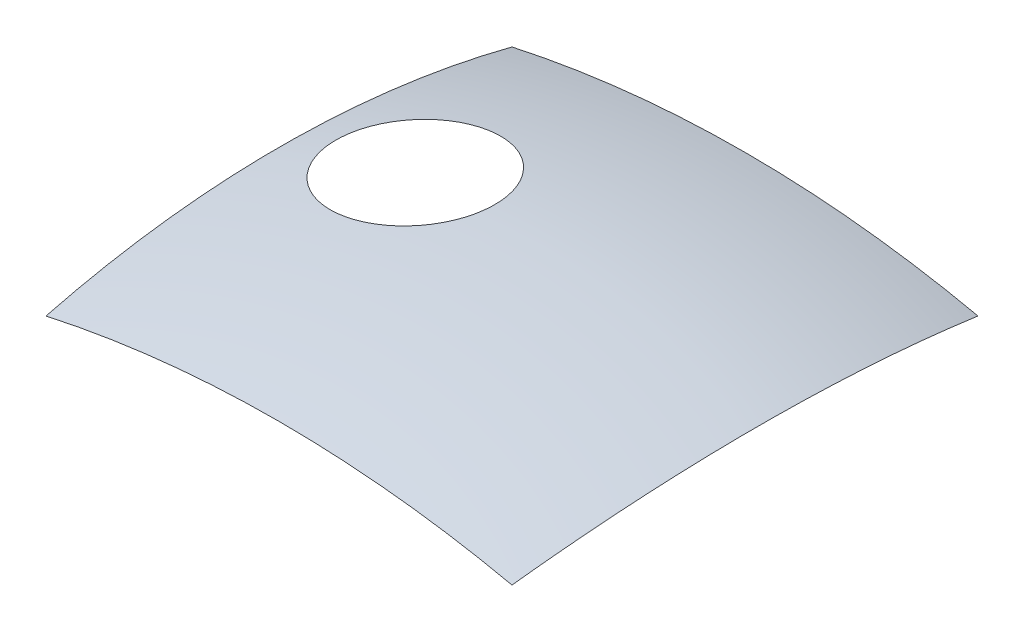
SolidWorks part; units mm, degrees
ref_plane "Front" through (0, 0, 0) normal (0, 0, 1) x (1, 0, 0)
ref_plane "Top" through (0, 0, 0) normal (0, 1, 0) x (1, 0, 0)
ref_plane "Right" through (0, 0, 0) normal (1, 0, 0) x (0, 0, -1)
sketch "Sketch1" plane through (0, 0, 0) normal (0, 0, -1) x (1, 0, 0)
  arc A0 (0, 0) -> (150, 0) centre (75, 341.8699) ccw
  dimension "D2" = 350
  dimension "D1" = 150
sketch "Sketch2" plane through (0, 0, 0) normal (1, 0, 0) x (0, 0, -1)
  arc A0 (0, 0) -> (-150, 0) centre (-75, -290.4738) ccw
  dimension "D1" = 150
  dimension "D2" = 300
surface "Surface-Sweep2"
sketch "Sketch3" plane through (0, 0, 0) normal (0, 1, 0) x (1, 0, 0)
  circle A0 centre (135.0796, -137.7512) radius 41.6905
  circle A1 centre (33.3713, -64.5026) radius 24.6523
surface "Surface-Trim1"
sketch "Sketch4" plane through (0, 0, 0) normal (0, 1, 0) x (1, 0, 0)
  line L0 (153.9258, -84.4261) -> (115.5408, -20.8612)
  line L1 (115.5408, -20.8612) -> (75, 0)
  line L2 (150, 0) -> (0, 0) construction
  ellipse E0 centre (28.403, -75) end of major axis (28.403, -375) minor radius 125.5848 (153.538, -100.3696) -> (150, 0) ccw construction
surface "Surface-Untrim5"
